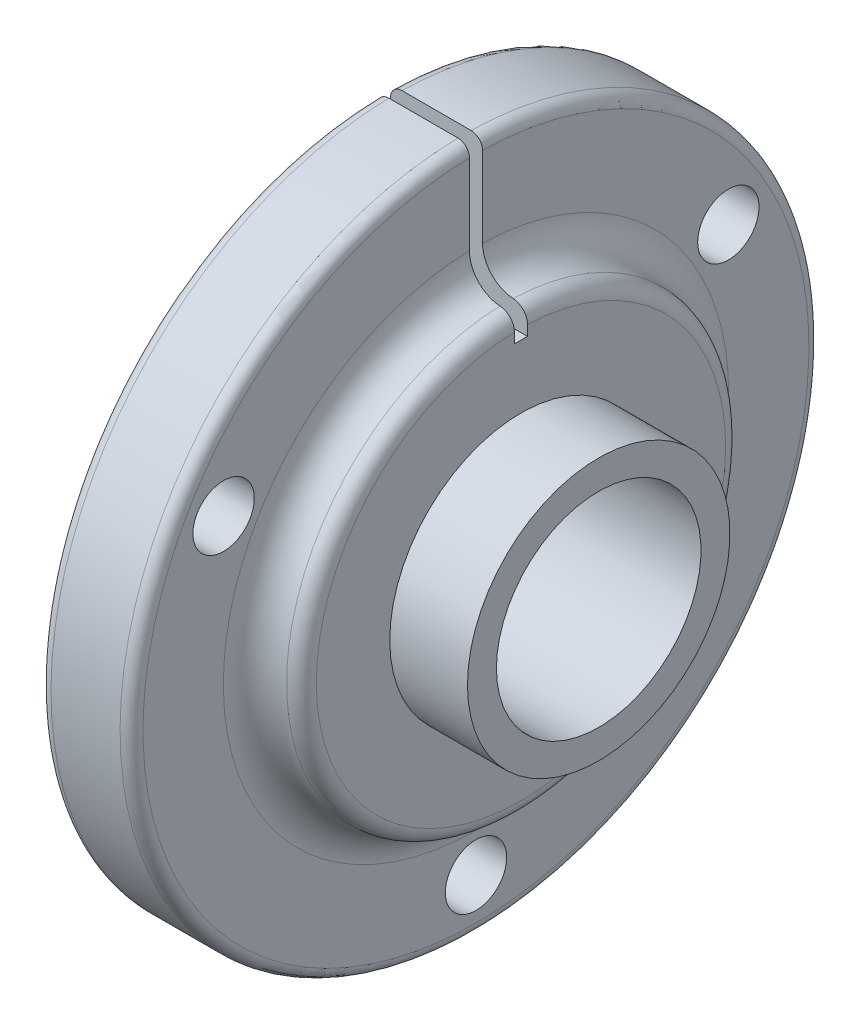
SolidWorks part; units mm, degrees
ref_plane "Front Plane" through (0, 0, 0) normal (0, 0, 1) x (1, 0, 0)
ref_plane "Top Plane" through (0, 0, 0) normal (0, 1, 0) x (1, 0, 0)
ref_plane "Right Plane" through (0, 0, 0) normal (1, 0, 0) x (0, 0, -1)
sketch "Sketch1" plane through (0, 0, 0) normal (0, 0, 1) x (1, 0, 0)
  line L0 (0, 0) -> (92.7751, 0) construction
  line L1 (-4.7752, 15.875) -> (33.3248, 15.875)
  line L2 (33.3248, 15.875) -> (33.3248, 20.3708)
  line L3 (33.3248, 20.3708) -> (21.2598, 20.3708)
  line L4 (21.2598, 20.3708) -> (21.2598, 34.1376)
  line L5 (14.2748, 39.2176) -> (14.2748, 53.467)
  line L6 (14.2748, 53.467) -> (0, 53.467)
  line L7 (0, 53.467) -> (0, 20.3708)
  line L8 (0, 20.3708) -> (-4.7752, 20.3708)
  line L9 (-4.7752, 20.3708) -> (-4.7752, 15.875)
  line L10 (21.2598, 34.1376) -> (19.3548, 34.1376)
  arc A1 (19.3548, 34.1376) -> (14.2748, 39.2176) centre (19.3548, 39.2176) cw
  dimension "D9" = 5.08
  dimension "D1" = 38.1
  dimension "D2" = 14.2748
  dimension "D3" = 4.7752
  dimension "D4" = 6.985
  dimension "D5" = 31.75
  dimension "D6" = 106.934
  dimension "D7" = 40.7416
  dimension "D8" = 68.2752
  dimension "D10" = 4.4958
revolve "Revolve1" add sketch "Sketch1" angle 360 about L0
fillet "Fillet1" radius 2.3876 1 edges at (21.2598, 0, 34.1376)
fillet "Fillet2" radius 1.778 2 edges at (0, 0, 53.467) (14.2748, 0, 53.467)
sketch "Sketch2" plane through (0, 0, 0) normal (1, 0, 0) x (0, 0, -1)
  line L0 (0, 30.1625) -> (0, 61.9125)
  dimension "D1" = 30.1625
  dimension "D2" = 31.75
extrude "Cut-Extrude-Thin1" cut sketch "Sketch2" against normal through all and the other way through all thin
sketch "Sketch3" plane through (0, 0, 0) normal (1, 0, 0) x (0, 0, -1)
  line L0 (0, 0) -> (0, 26.5146) construction
  line L1 (0, 0) -> (0, -45.2374) construction
  line L2 (0, 0) -> (39.1767, 22.6187) construction
  line L3 (0, 0) -> (-39.1767, 22.6187) construction
  line L4 (-25.9471, -37.0563) -> (0, 0) construction
  circle A0 centre (-39.1767, 22.6187) radius 4.7625
  circle A1 centre (39.1767, 22.6187) radius 4.7625
  circle A2 centre (0, -45.2374) radius 4.7625
  circle A3 centre (-25.9471, -37.0563) radius 4.7625 construction
  circle A4 centre (0, 0) radius 45.2374 construction
  dimension "D4" = 9.525
  dimension "D8" = 90.4748
  dimension "D5" = 90.4748
  dimension "D1" = 120
  dimension "D2" = 120
  dimension "D3" = 78.3535
  dimension "D6" = 45.2374
  dimension "D7" = 35
extrude "Cut-Extrude1" cut sketch "Sketch3" along normal through all
sketch "Sketch4" plane through (0, 0, 0) normal (1, 0, 0) x (0, 0, -1)
  line L0 (0, 0) -> (44.4811, -11.9187) construction
  line L1 (0, 0) -> (-11.9187, -44.4811) construction
  line L2 (0, 0) -> (-44.4811, 11.9187) construction
  line L3 (0, 0) -> (67.5756, 0) construction
  circle A0 centre (0, 0) radius 46.0502 construction
  circle A1 centre (44.4811, -11.9187) radius 3.9624
  circle A2 centre (-11.9187, -44.4811) radius 3.9624
  circle A3 centre (-44.4811, 11.9187) radius 3.9624
  circle A4 centre (39.1767, 22.6187) radius 4.7625 construction
  circle A5 centre (-39.1767, 22.6187) radius 4.7625 construction
  circle A6 centre (39.1767, 22.6187) radius 4.7625 construction
  circle A7 centre (-39.1767, 22.6187) radius 4.7625 construction
  dimension "D1" = 92.1004
  dimension "D2" = 7.9248
  dimension "D4" = 34.9423
  dimension "D5" = 11.9426
  dimension "D3" = 15
extrude "Cut-Extrude2" [suppressed] cut sketch "Sketch4" along normal blind 25.4
sketch "Sketch5" plane through (0, 0, 0) normal (1, 0, 0) x (0, 0, -1)
  line L0 (0, 0) -> (73.6333, 0) construction
  line L1 (0, 0) -> (39.1767, -22.6187) construction
  line L2 (0, 0) -> (-39.1767, -22.6187) construction
  line L3 (0, 0) -> (39.1767, 22.6187) construction
  circle A0 centre (0, 0) radius 45.2374 construction
  circle A1 centre (-39.1767, 22.6187) radius 4.7625 construction
  circle A2 centre (39.1767, 22.6187) radius 4.7625 construction
  circle A3 centre (-39.1767, 22.6187) radius 4.7625 construction
  circle A4 centre (39.1767, 22.6187) radius 4.7625 construction
  circle A5 centre (-39.1767, -22.6187) radius 4.7625
  circle A6 centre (39.1767, -22.6187) radius 4.7625
  dimension "D1" = 90.4748
  dimension "D2" = 9.525
  dimension "D3" = 30
  dimension "D4" = 30
extrude "Cut-Extrude4" [suppressed] cut sketch "Sketch5" along normal blind 25.4
sketch "Sketch8" plane through (0, 0, 0) normal (1, 0, 0) x (0, 0, -1)
  line L0 (0, 0) -> (0, 64.9081) construction
  line L1 (-76.2, -38.1) -> (-50.8, -38.1)
  line L2 (-76.2, -38.1) -> (-76.2, 38.1)
  line L3 (-76.2, 38.1) -> (-50.8, 38.1)
  line L4 (-50.8, -38.1) -> (-50.8, 38.1)
  line L5 (50.8, -38.1) -> (76.2, -38.1)
  line L6 (50.8, -38.1) -> (50.8, 38.1)
  line L7 (50.8, 38.1) -> (76.2, 38.1)
  line L8 (76.2, -38.1) -> (76.2, 38.1)
  line L10 (-31.75, -50.8) -> (31.75, -50.8)
  line L11 (-31.75, -50.8) -> (-31.75, -69.85)
  line L12 (-31.75, -69.85) -> (31.75, -69.85)
  line L13 (31.75, -50.8) -> (31.75, -69.85)
  line L14 (-31.75, -50.8) -> (31.75, -69.85) construction
  line L15 (-31.75, -69.85) -> (31.75, -50.8) construction
  point P11 (0, -60.325)
  dimension "D1" = 101.6
  dimension "D2" = 38.1
  dimension "D3" = 76.2
  dimension "D4" = 25.4
  dimension "D5" = 50.8
  dimension "D6" = 19.05
  dimension "D7" = 63.5
extrude "Cut-Extrude5" [suppressed] cut sketch "Sketch8" along normal blind 50.8
fillet "Fillet3" [suppressed] radius 3.175
